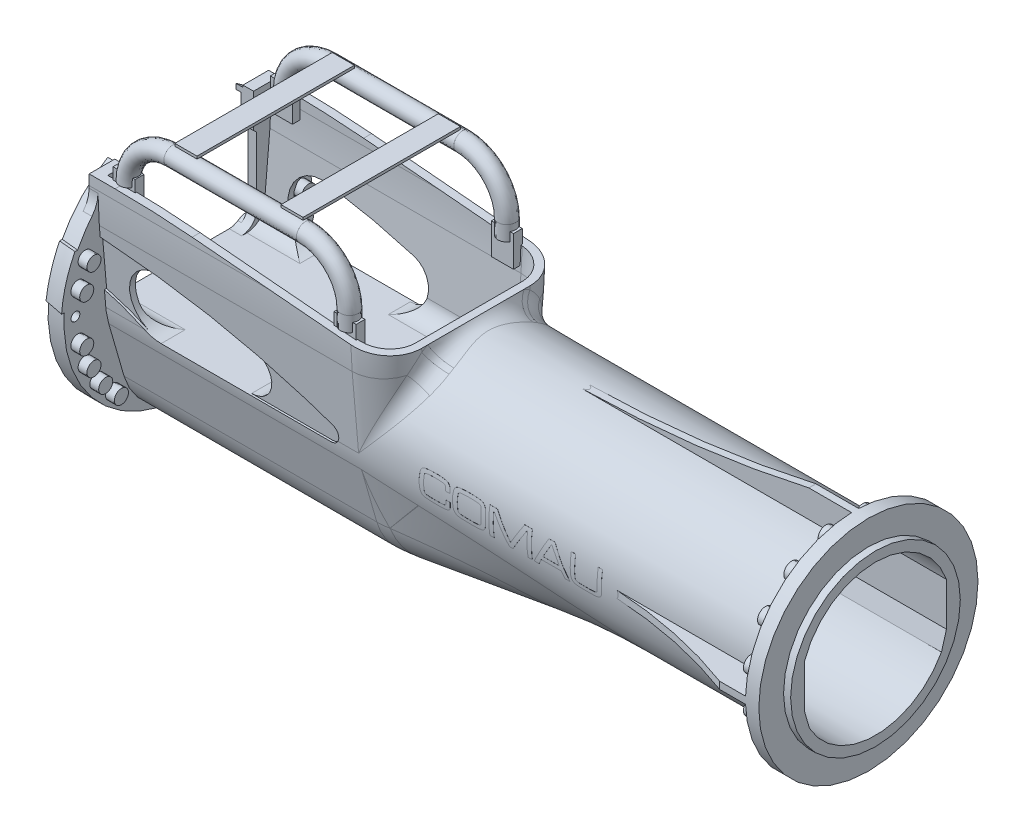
SolidWorks part; units mm, degrees
ref_plane "Piano1 (Front/Back)" through (0, 0, 0) normal (0, 0, 1) x (1, 0, 0)
ref_plane "Piano2 (Top/Bottom)" through (0, 0, 0) normal (0, 1, 0) x (1, 0, 0)
ref_plane "Piano3 (Left/Right)" through (0, 0, 0) normal (1, 0, 0) x (0, 0, -1)
imported_body "Importato1"
sketch "Schizzo1" plane through (0, 0, -80.326) normal (0, 0, 1) x (1, 0, 0)
  line L0 (-207, -15) -> (-417, -15) construction
  line L1 (8, -12.5) -> (8, 12.5) construction
  line L2 (8, -156) -> (8, 156) construction
  text T0 "COMAU" font "MicrogrammaDMedExt" height 30
  point P2 (8, 0)
  point P5 (-312, -15)
  dimension "D1" = 15
  dimension "D2" = 210
  dimension "D3" = 320
extrude "Estrusione1" add sketch "Schizzo1" against normal offset from surface (12.1736 mm away) 0.1
sketch "Schizzo2" plane through (0, 0, 80.326) normal (0, 0, -1) x (-1, 0, 0)
  line L0 (417, -15) -> (207, -15) construction
  text T0 "COMAU" font "MicrogrammaDMedExt" height 30
  point P2 (312, -15)
  dimension "D1" = 15
  dimension "D2" = 210
  dimension "D3" = 320
extrude "Estrusione2" add sketch "Schizzo2" against normal offset from surface (12.1736 mm away) 0.1
sketch "Schizzo3" plane through (0, 0, 0) normal (0, 0, 1) x (1, 0, 0)
  line L0 (0, 0) -> (77.7591, 0) construction
  line L1 (8, -156) -> (8, 156) construction
  line L2 (8, 124) -> (-142, 124)
  line L3 (8, 124) -> (8, 224)
  line L4 (8, 224) -> (-142, 224)
  line L5 (-142, 124) -> (-142, 224)
  dimension "D1" = 248
  dimension "D2" = 100
  dimension "D3" = 150
revolve "Taglia-Rivoluzione1" cut sketch "Schizzo3" angle 360 about L0
